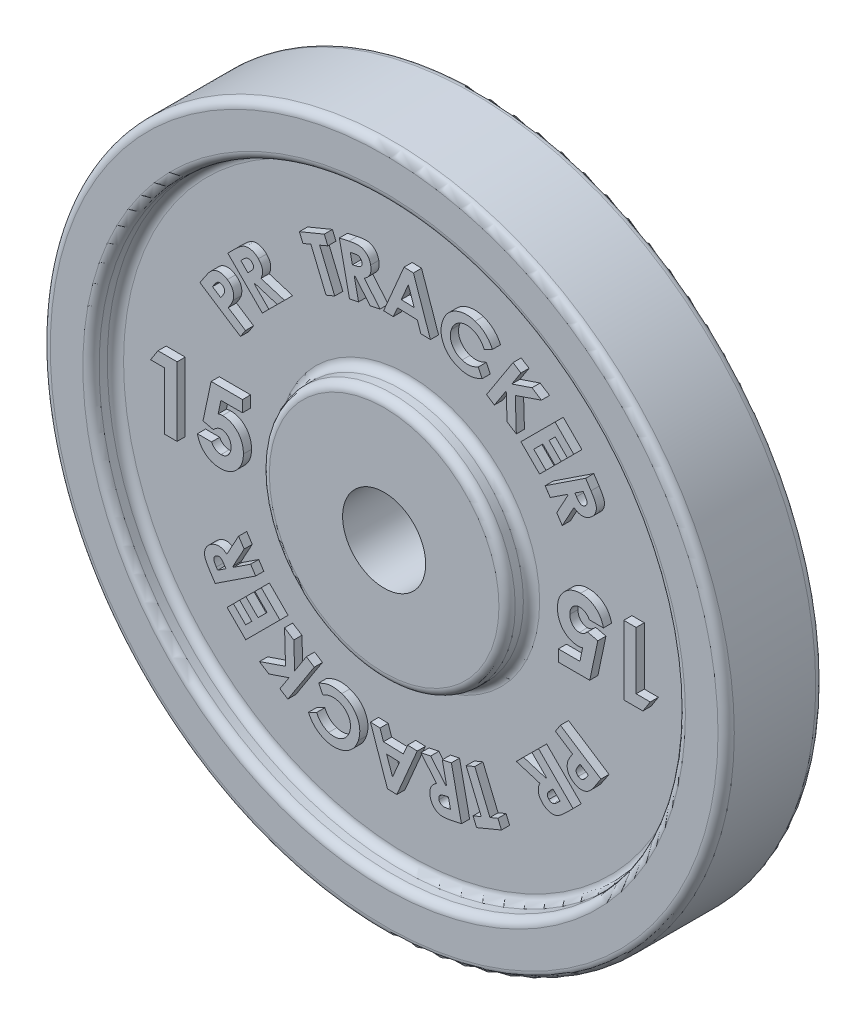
SolidWorks part; units mm, degrees
ref_plane "Plano frontal" through (0, 0, 0) normal (0, 0, 1) x (1, 0, 0)
ref_plane "Plano superior" through (0, 0, 0) normal (0, 1, 0) x (1, 0, 0)
ref_plane "Plano direito" through (0, 0, 0) normal (1, 0, 0) x (0, 0, -1)
sketch "Esboço1" plane through (0, 0, 0) normal (0, 0, 1) x (1, 0, 0)
  circle A0 centre (0, 0) radius 21
  circle A1 centre (0, 0) radius 2.55
  dimension "D1" = 42
  dimension "D2" = 5.1
extrude "Ressalto-extrusão1" add sketch "Esboço1" along normal blind 6
sketch "Esboço2" plane through (0, 0, 6) normal (0, 0, 1) x (1, 0, 0)
  circle A0 centre (0, 0) radius 18
  circle A1 centre (0, 0) radius 21
  circle A2 centre (0, 0) radius 21
  circle A5 centre (0, 0) radius 7.55
  circle A6 centre (0, 0) radius 7.55
  dimension "D1" = 0
  dimension "D2" = 3
  dimension "D3" = 5
extrude "Corte-extrusão1" cut sketch "Esboço2" against normal blind 1.5 contours A0 A6
fillet "Filete1" radius 0.5 4 edges at (7.55, 0, 4.5) (18, 0, 4.5) (7.55, 0, 6) (18, 0, 6)
sketch "Esboço3" plane through (0, 0, 4.5) normal (0, 0, 1) x (1, 0, 0)
  arc A0 (11.25, 0) -> (-11.25, 0) centre (0, 0) ccw construction
  text T0 "<b>PR  TRACKER</b>" font "Century Gothic" height 3
  dimension "D1" = 22.5
extrude "Ressalto-extrusão2" add sketch "Esboço3" along normal blind 0.5
sketch "Esboço5" plane through (0, 0, 4.5) normal (0, 0, 1) x (1, 0, 0)
  line L0 (-17.3735, -2.1) -> (-7.7713, -2.1) construction
  line L1 (0, 0) -> (-17.5, 0) construction
  circle A2 centre (0, 0) radius 17.5 construction
  circle A3 centre (0, 0) radius 8.05 construction
  text T0 "<b>15</b>" font "Century Gothic" height in points 16
  dimension "D1" = 2.1
extrude "Ressalto-extrusão3" add sketch "Esboço5" along normal blind 0.5
pattern_circular "PadrãoCircular1" count 2 over 360 about axis through (0, 0, 6) along (0, 0, 1) of "Ressalto-extrusão2", "Ressalto-extrusão3"
ref_plane "Plano1" through (0, 0, 3) normal (0, 0, 1) x (1, 0, 0)
fillet "Filete2" radius 0.5 2 edges at (21, 0, 0) (21, 0, 6)
mirror "Espelhar6" about plane through (0, 0, 3) normal (0, 0, 1) of "Corte-extrusão1"
fillet "Filete3" radius 0.5 4 edges at (18, 0, 1.5) (7.55, 0, 0) (18, 0, 0) (7.55, 0, 1.5)
sketch "Esboço10" plane through (0, 0, 1.5) normal (0, 0, -1) x (-1, 0, 0)
  line L0 (-11.25, 0) -> (11.25, 0) construction
  arc A0 (11.25, 0) -> (-11.25, 0) centre (0, 0) ccw construction
  text T0 "<b>PR  TRACKER</b>" font "Century Gothic" height 3
  dimension "D1" = 22.5
extrude "Ressalto-extrusão4" add sketch "Esboço10" along normal blind 0.5
sketch "Esboço12" plane through (0, 0, 1.5) normal (0, 0, -1) x (-1, 0, 0)
  line L0 (-17.3735, -2.1) -> (-7.2521, -2.1) construction
  circle A0 centre (0, 0) radius 17.5 construction
  circle A1 centre (0, 0) radius 7.55 construction
  text T0 "<b>15</b>" font "Century Gothic" height in points 16
  dimension "D1" = 2.1
extrude "Ressalto-extrusão5" add sketch "Esboço12" along normal blind 0.5
pattern_circular "PadrãoCircular2" count 2 over 360 about axis through (0, 0, 0) along (0, 0, 1) of "Ressalto-extrusão4", "Ressalto-extrusão5"
